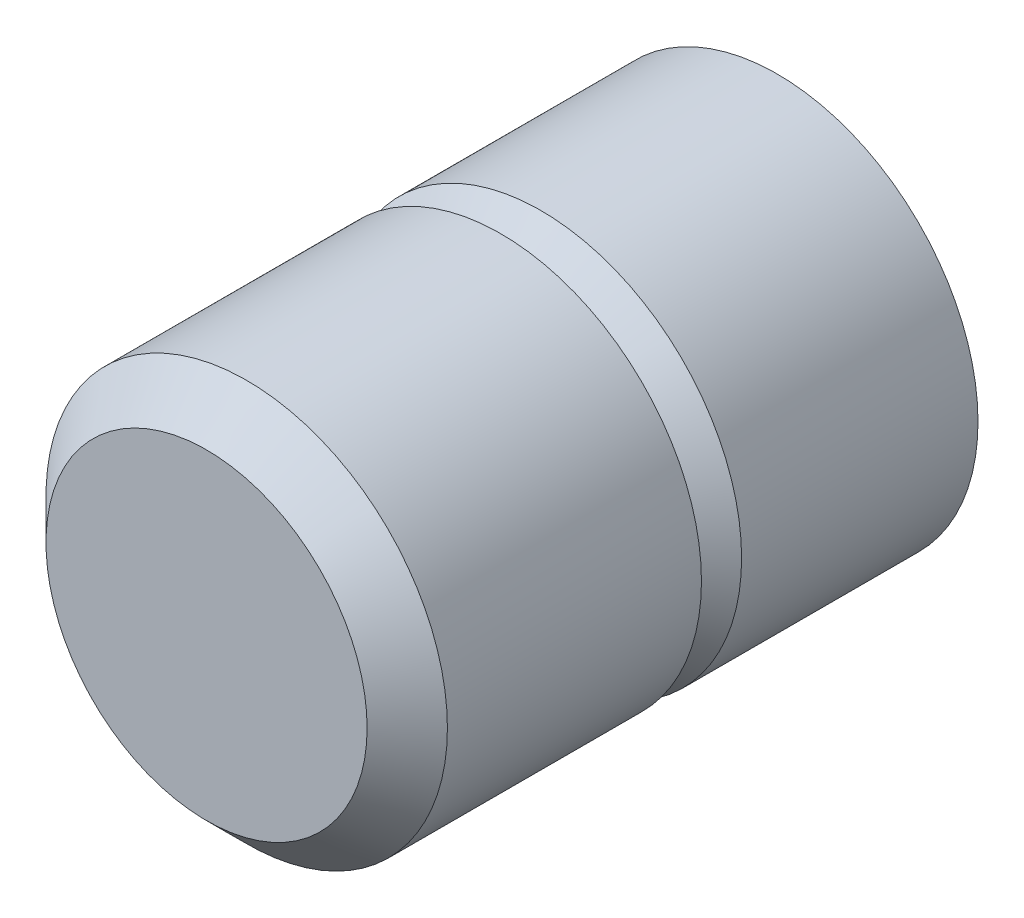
SolidWorks part; units mm, degrees
ref_plane "Front" through (0, 0, 0) normal (0, 0, 1) x (1, 0, 0)
ref_plane "Top" through (0, 0, 0) normal (0, 1, 0) x (1, 0, 0)
ref_plane "Right" through (0, 0, 0) normal (1, 0, 0) x (0, 0, -1)
sketch "Sketch1" plane through (0, 0, 0) normal (1, 0, 0) x (0, 0, -1)
  line L0 (0, 0) -> (65.3053, 0) construction
  line L1 (0, 0) -> (0, 6.0025)
  line L2 (0, 6.0025) -> (1.5006, 7.5032)
  line L3 (1.5006, 7.5032) -> (10.9982, 7.5032)
  line L4 (10.9982, 7.5032) -> (10.9982, 6.0025)
  line L5 (10.9982, 6.0025) -> (12.4988, 7.5032)
  line L6 (12.4988, 7.5032) -> (21.336, 7.5032)
  line L7 (21.336, 7.5032) -> (21.336, 5.715)
  line L8 (21.336, 5.715) -> (22.606, 6.35)
  line L9 (22.606, 6.35) -> (53.34, 6.35)
  line L10 (53.34, 6.35) -> (54.61, 5.08)
  line L11 (54.61, 5.08) -> (54.61, 0)
  line L12 (0, 0) -> (54.61, 0)
  dimension "D" = 15.0063
  dimension "DChamp1" = 1.5006
  dimension "DChamp2" = 1.5006
  dimension "E" = 10.9982
  dimension "DChamp4" = 1.5006
  dimension "DChamp3" = 1.5006
  dimension "B" = 21.336
  dimension "CChamp1" = 1.27
  dimension "A" = 54.61
  dimension "CChamp3" = 1.27
  dimension "CChamp4" = 1.27
  dimension "C" = 12.7
  dimension "D2" = 15.0063
  dimension "CChamp5" = 11.43
revolve "Revolve1" add sketch "Sketch1" angle 360 about L0
sketch "Sketch2" plane through (0, 0, -21.336) normal (0, 0, -1) x (-1, 0, 0)
  circle A0 centre (0, 0) radius 53.975
  dimension "D1" = 107.95
extrude "Type123-N" cut sketch "Sketch2" along normal through all
sketch "123KeyDepth" [suppressed] plane through (0, 0, -28.448) normal (0, 0, -1) x (-1, 0, 0)
  line L0 (0, 0) -> (0, 1.5748) construction
  line L1 (-0.5766, 1.5748) -> (0.5714, 1.5748) construction
  dimension "KeyDepth" = 4.7625
ref_plane "123Plane" [suppressed] through (0, 1.5748, 0) normal (0, -1, 0) x (1, 0, 0)
sketch "Sketch4" [suppressed] plane through (0, 1.5748, 0) normal (0, -1, 0) x (1, 0, 0)
  line L0 (0.0026, -28.448) -> (0.0026, -38.0533) construction
  line L1 (0.5766, -28.448) -> (-0.5714, -28.448) construction
  line L2 (0.8027, -28.448) -> (0.8027, -19.812)
  line L3 (-0.7975, -19.812) -> (-0.7975, -28.448)
  line L5 (-3.9689, -19.812) -> (2.9563, -19.812) construction
  line L6 (-1.8999, -28.448) -> (1.8999, -28.448) construction
  line L7 (-0.7975, -28.448) -> (0.8027, -28.448)
  arc A0 (0.8027, -19.812) -> (-0.7975, -19.812) centre (0.0026, -19.812) ccw
  dimension "F" = 3.175
  dimension "G" = 22.86
extrude "123Key" [suppressed] cut sketch "Sketch4" against normal through all
sketch "Sketch5" plane through (0, 0, -10.9982) normal (0, 0, -1) x (-1, 0, 0)
  circle A0 centre (0, 0) radius 63.5
  dimension "D1" = 127
extrude "Type4" [suppressed] cut sketch "Sketch5" along normal through all
chamfer "Type4-Chamfer" [suppressed] distance 2.54 angle 45
sketch "4KeyDepth" [suppressed] plane through (0, 0, -72.136) normal (0, 0, -1) x (-1, 0, 0)
  line L0 (0, 0) -> (0, 9.525) construction
  line L1 (-17.7759, 9.525) -> (18.3619, 9.525) construction
  dimension "Type4KeyDepth" = 6.2332
ref_plane "4Plane" [suppressed] through (0, 9.525, 0) normal (0, -1, 0) x (1, 0, 0)
sketch "Sketch7" [suppressed] plane through (0, 9.525, 0) normal (0, -1, 0) x (1, 0, 0)
  line L0 (-0.293, -72.136) -> (-0.293, -158.7004) construction
  line L1 (17.7759, -72.136) -> (-18.3619, -72.136) construction
  line L2 (2.882, -72.136) -> (2.882, -32.0291)
  line L3 (-3.468, -72.136) -> (-3.468, -32.0291)
  line L4 (-3.468, -72.136) -> (2.882, -72.136)
  line L5 (-10.16, -72.136) -> (10.16, -72.136) construction
  line L6 (-10.16, -72.136) -> (10.16, -72.136) construction
  arc A0 (2.882, -32.0291) -> (-3.468, -32.0291) centre (-0.293, -34.036) ccw
  dimension "4F" = 2.54
  dimension "4G" = 2.54
  dimension "4F2" = 1.27
extrude "4Key" [suppressed] cut sketch "Sketch7" against normal through all
equation "\"DChamp3@Sketch1\"=.1*\"D@Sketch1\""
equation "\"DChamp1@Sketch1\"=.1*\"D@Sketch1\""
equation "\"DChamp2@Sketch1\"=.1*\"D@Sketch1\""
equation "\"DChamp4@Sketch1\"=.1*\"D@Sketch1\""
equation "\"CChamp1@Sketch1\"=.1*\"C@Sketch1\""
equation "\"CChamp5@Sketch1\"=.9*\"C@Sketch1\""
equation "\"CChamp3@Sketch1\"=.1*\"C@Sketch1\""
equation "\"CChamp4@Sketch1\"=.1*\"C@Sketch1\""
equation "\"D2@Sketch1\"=\"D@Sketch1\""
equation "\"KeyDepth@123KeyDepth\"=(\"C@Sketch1\"/2)-(\"F@Sketch4\"/2)"
equation "\"Type4KeyDepth@4KeyDepth\"=(\"D@Sketch1\"/2)-(\"4F@Sketch7\"/2)"
equation "\"4F2@Sketch7\"=\"4F@Sketch7\"/2"
